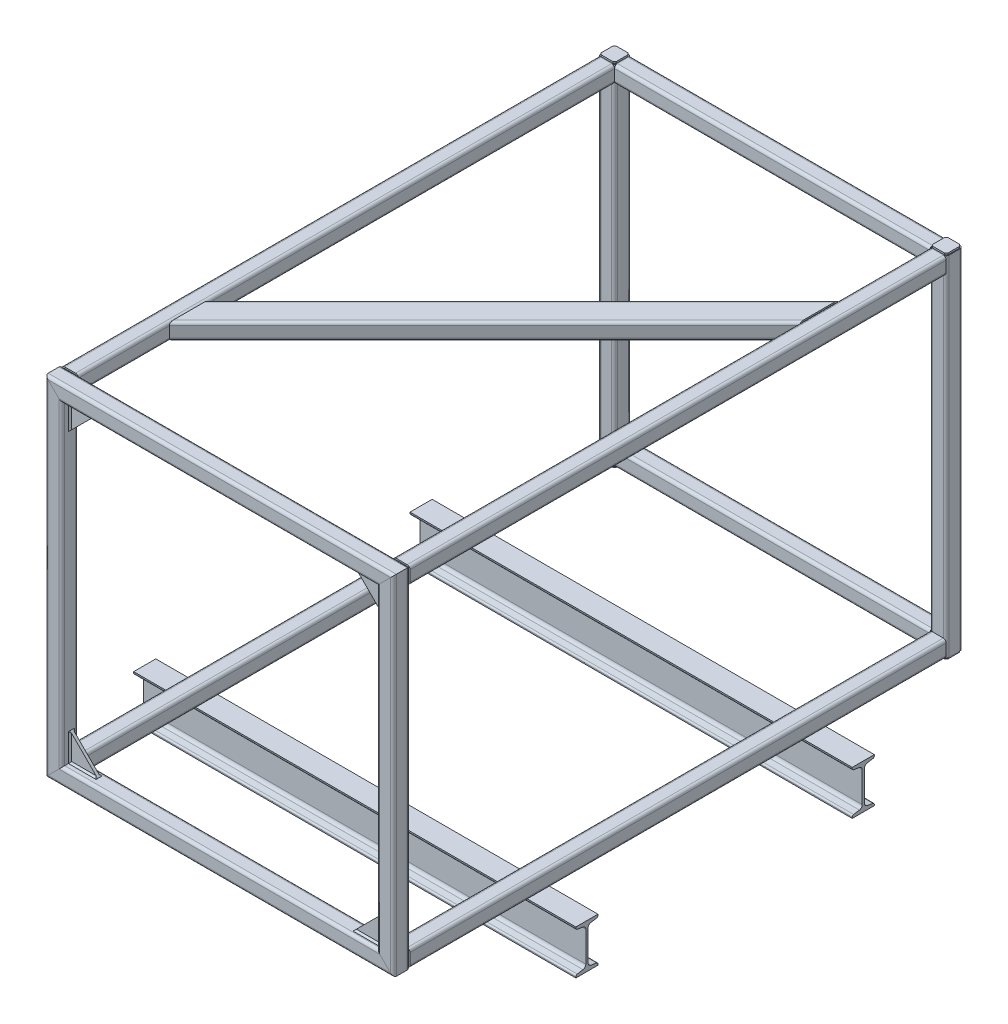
SolidWorks part; units mm, degrees
other "DetailItem1"
other "DetailItem2"
other "DetailItem4"
other "DetailItem5"
ref_plane "Front Plane" through (0, 0, 0) normal (0, 0, 1) x (1, 0, 0)
ref_plane "Top Plane" through (0, 0, 0) normal (0, 1, 0) x (1, 0, 0)
ref_plane "Right Plane" through (0, 0, 0) normal (1, 0, 0) x (0, 0, -1)
sketch "Sketch1" plane through (0, 0, 0) normal (0, 0, 1) x (1, 0, 0)
  line L1 (0, 0) -> (600, 0)
  line L2 (0, 0) -> (0, 600)
  line L3 (0, 600) -> (600, 600)
  line L4 (600, 0) -> (600, 600)
  dimension "D1" = 600
  dimension "D2" = 600
sketch3d "3DSketch1"
  line L0 (0, 0, 0) -> (0, 0, -1000)
  line L1 (600, 0, 0) -> (600, 0, -1000)
  line L2 (600, 600, 0) -> (600, 600, -1000)
  line L3 (0, 600, 0) -> (0, 600, -1000)
  line L4 (0, 0, -1000) -> (0, 600, -1000)
  line L5 (0, 600, -1000) -> (600, 600, -1000)
  line L6 (600, 600, -1000) -> (600, 0, -1000)
  line L7 (600, 0, -1000) -> (0, 0, -1000)
  dimension "D1" = 1000
  dimension "D2" = 1000
  dimension "D3" = 1000
  dimension "D4" = 1000
ref_plane "Plane1" through (0, 600, 0) normal (0, 1, 0) x (-1, 0, 0)
sketch "Sketch2" plane through (0, 600, 0) normal (0, 1, 0) x (-1, 0, 0)
  line L0 (-600, -800) -> (0, -200)
  line L1 (-600, 0) -> (-600, -1000) construction
  line L2 (0, 0) -> (0, -1000) construction
  dimension "D1" = 200
  dimension "D2" = 200
other "Structural Member1"
ref_plane "Plane3" through (0, 0, 0) normal (0, 1, 0) x (-1, 0, 0)
sketch "Sketch12" plane through (0, 0, 0) normal (0, 1, 0) x (-1, 0, 0)
  line L0 (-9.8, -12.4) -> (9.8, -12.4)
  line L1 (-12.4, -9.8) -> (-12.4, 9.8)
  line L2 (9.8, 12.4) -> (-9.8, 12.4)
  line L3 (12.4, 9.8) -> (12.4, -9.8)
  line L4 (-9.8, -15) -> (9.8, -15)
  line L5 (-15, -9.8) -> (-15, 9.8)
  line L6 (9.8, 15) -> (-9.8, 15)
  line L7 (15, 9.8) -> (15, -9.8)
  arc A0 (15, 9.8) -> (9.8, 15) centre (9.8, 9.8) ccw
  arc A1 (9.8, -15) -> (15, -9.8) centre (9.8, -9.8) ccw
  arc A2 (-15, -9.8) -> (-9.8, -15) centre (-9.8, -9.8) ccw
  arc A3 (-9.8, 15) -> (-15, 9.8) centre (-9.8, 9.8) ccw
  arc A4 (-9.8, 12.4) -> (-12.4, 9.8) centre (-9.8, 9.8) ccw
  arc A5 (12.4, 9.8) -> (9.8, 12.4) centre (9.8, 9.8) ccw
  arc A6 (9.8, -12.4) -> (12.4, -9.8) centre (9.8, -9.8) ccw
  arc A7 (-12.4, -9.8) -> (-9.8, -12.4) centre (-9.8, -9.8) ccw
  point P0 (-15, 0)
  point P1 (15, 0)
  point P2 (0, 15)
  point P3 (0, -15)
  point P4 (0, 0)
  point P5 (-15, -15)
  point P6 (15, -15)
  point P7 (15, 15)
  point P8 (-15, 15)
  point P33 (0, 0)
  dimension "D1" = 5.2
  dimension "Thickness" = 2.6
  dimension "V_leg" = 30
other "Structural Member2"
ref_plane "Plane4" through (0, 600, 0) normal (0, 0, -1) x (-1, 0, 0)
sketch "Sketch13" plane through (0, 600, 0) normal (0, 0, -1) x (-1, 0, 0)
  line L0 (-9.8, -12.4) -> (9.8, -12.4)
  line L1 (-12.4, -9.8) -> (-12.4, 9.8)
  line L2 (9.8, 12.4) -> (-9.8, 12.4)
  line L3 (12.4, 9.8) -> (12.4, -9.8)
  line L4 (-9.8, -15) -> (9.8, -15)
  line L5 (-15, -9.8) -> (-15, 9.8)
  line L6 (9.8, 15) -> (-9.8, 15)
  line L7 (15, 9.8) -> (15, -9.8)
  arc A0 (15, 9.8) -> (9.8, 15) centre (9.8, 9.8) ccw
  arc A1 (9.8, -15) -> (15, -9.8) centre (9.8, -9.8) ccw
  arc A2 (-15, -9.8) -> (-9.8, -15) centre (-9.8, -9.8) ccw
  arc A3 (-9.8, 15) -> (-15, 9.8) centre (-9.8, 9.8) ccw
  arc A4 (-9.8, 12.4) -> (-12.4, 9.8) centre (-9.8, 9.8) ccw
  arc A5 (12.4, 9.8) -> (9.8, 12.4) centre (9.8, 9.8) ccw
  arc A6 (9.8, -12.4) -> (12.4, -9.8) centre (9.8, -9.8) ccw
  arc A7 (-12.4, -9.8) -> (-9.8, -12.4) centre (-9.8, -9.8) ccw
  point P0 (-15, 0)
  point P1 (15, 0)
  point P2 (0, 15)
  point P3 (0, -15)
  point P4 (0, 0)
  point P5 (-15, -15)
  point P6 (15, -15)
  point P7 (15, 15)
  point P8 (-15, 15)
  point P33 (0, 0)
  dimension "D1" = 5.2
  dimension "Thickness" = 2.6
  dimension "V_leg" = 30
other "Structural Member3"
ref_plane "Plane5" through (0, 0, -1000) normal (0, 1, 0) x (-1, 0, 0)
sketch "Sketch14" plane through (0, 0, -1000) normal (0, 1, 0) x (-1, 0, 0)
  line L0 (-9.8, -12.4) -> (9.8, -12.4)
  line L1 (-12.4, -9.8) -> (-12.4, 9.8)
  line L2 (9.8, 12.4) -> (-9.8, 12.4)
  line L3 (12.4, 9.8) -> (12.4, -9.8)
  line L4 (-9.8, -15) -> (9.8, -15)
  line L5 (-15, -9.8) -> (-15, 9.8)
  line L6 (9.8, 15) -> (-9.8, 15)
  line L7 (15, 9.8) -> (15, -9.8)
  arc A0 (15, 9.8) -> (9.8, 15) centre (9.8, 9.8) ccw
  arc A1 (9.8, -15) -> (15, -9.8) centre (9.8, -9.8) ccw
  arc A2 (-15, -9.8) -> (-9.8, -15) centre (-9.8, -9.8) ccw
  arc A3 (-9.8, 15) -> (-15, 9.8) centre (-9.8, 9.8) ccw
  arc A4 (-9.8, 12.4) -> (-12.4, 9.8) centre (-9.8, 9.8) ccw
  arc A5 (12.4, 9.8) -> (9.8, 12.4) centre (9.8, 9.8) ccw
  arc A6 (9.8, -12.4) -> (12.4, -9.8) centre (9.8, -9.8) ccw
  arc A7 (-12.4, -9.8) -> (-9.8, -12.4) centre (-9.8, -9.8) ccw
  point P0 (-15, 0)
  point P1 (15, 0)
  point P2 (0, 15)
  point P3 (0, -15)
  point P4 (0, 0)
  point P5 (-15, -15)
  point P6 (15, -15)
  point P7 (15, 15)
  point P8 (-15, 15)
  point P33 (0, 0)
  dimension "D1" = 5.2
  dimension "Thickness" = 2.6
  dimension "V_leg" = 30
other "Structural Member4"
ref_plane "Plane6" through (600, 600, -800) normal (-0.7071, 0, 0.7071) x (0.7071, 0, 0.7071)
sketch "Sketch15" plane through (600, 600, -800) normal (-0.7071, 0, 0.7071) x (0, -1, 0)
  line L0 (-9.8, -22.4) -> (9.8, -22.4)
  line L1 (-12.4, -19.8) -> (-12.4, 19.8)
  line L2 (9.8, 22.4) -> (-9.8, 22.4)
  line L3 (12.4, 19.8) -> (12.4, -19.8)
  line L4 (-9.8, -25) -> (9.8, -25)
  line L5 (-15, -19.8) -> (-15, 19.8)
  line L6 (9.8, 25) -> (-9.8, 25)
  line L7 (15, 19.8) -> (15, -19.8)
  arc A0 (15, 19.8) -> (9.8, 25) centre (9.8, 19.8) ccw
  arc A1 (9.8, -25) -> (15, -19.8) centre (9.8, -19.8) ccw
  arc A2 (-15, -19.8) -> (-9.8, -25) centre (-9.8, -19.8) ccw
  arc A3 (-9.8, 25) -> (-15, 19.8) centre (-9.8, 19.8) ccw
  arc A4 (-9.8, 22.4) -> (-12.4, 19.8) centre (-9.8, 19.8) ccw
  arc A5 (12.4, 19.8) -> (9.8, 22.4) centre (9.8, 19.8) ccw
  arc A6 (9.8, -22.4) -> (12.4, -19.8) centre (9.8, -19.8) ccw
  arc A7 (-12.4, -19.8) -> (-9.8, -22.4) centre (-9.8, -19.8) ccw
  point P0 (0, 25)
  point P1 (15, 0)
  point P2 (0, -25)
  point P3 (-15, 0)
  point P4 (-15, 25)
  point P5 (15, 25)
  point P6 (15, -25)
  point P7 (-15, -25)
  point P8 (0, 0)
  point P33 (0, 0)
  dimension "D1" = 5.2
  dimension "Thickness" = 2.6
  dimension "V_leg" = 50
  dimension "H_leg" = 30
other "Trim/Extend1"
other "Trim/Extend2"
other "Trim/Extend3"
other "Trim/Extend4"
other "Trim/Extend5"
other "Trim/Extend6"
other "Trim/Extend7"
other "End cap1" parameters "D1"=3, "D2"=3, "D3"=3
other "End cap2" parameters "D1"=3, "D2"=3, "D3"=3
other "End cap3" parameters "D1"=3, "D2"=3, "D3"=3
other "End cap4" parameters "D1"=3, "D2"=3, "D3"=3
other "Gusset1" parameters "D1"=5, "D2"=5, "D3"=0, "D4"=0, "D10"=5, "D11"=50, "D12"=50, "D13"=15, "D14"=45, "D15"=15
sketch "Sketch16" plane through (15, 15, 0) normal (0, 0, -1) x (-1, 0, 0)
  line L0 (0, 0) -> (0, 50)
  line L1 (0, 0) -> (-50, 0)
  line L2 (0, 50) -> (-50, 0)
other "Gusset2" parameters "D1"=5, "D2"=5, "D3"=0, "D4"=0, "D10"=5, "D11"=50, "D12"=50, "D13"=15, "D14"=45, "D15"=15
sketch "Sketch17" plane through (15, 585, 0) normal (0, 0, -1) x (-1, 0, 0)
  line L0 (0, 0) -> (-50, 0)
  line L1 (0, 0) -> (0, -50)
  line L2 (-50, 0) -> (0, -50)
other "Gusset3" parameters "D1"=5, "D2"=5, "D3"=0, "D4"=0, "D10"=5, "D11"=50, "D12"=50, "D13"=15, "D14"=45, "D15"=15
sketch "Sketch18" plane through (585, 585, 0) normal (0, 0, 1) x (1, 0, 0)
  line L0 (0, 0) -> (-50, 0)
  line L1 (0, 0) -> (0, -50)
  line L2 (-50, 0) -> (0, -50)
other "Gusset4" parameters "D1"=5, "D2"=5, "D3"=0, "D4"=0, "D10"=5, "D11"=50, "D12"=50, "D13"=15, "D14"=45, "D15"=15
sketch "Sketch19" plane through (585, 15, 0) normal (0, 0, 1) x (1, 0, 0)
  line L0 (0, 0) -> (0, 50)
  line L1 (0, 0) -> (-50, 0)
  line L2 (0, 50) -> (-50, 0)
other "Fillet Bead1" parameters "D10"=6, "D11"=3, "D12"=3, "D13"=3, "D14"=3
other "Fillet Bead2" parameters "D10"=6, "D11"=3, "D12"=3, "D13"=3, "D14"=3
other "Fillet Bead3" parameters "D10"=6, "D11"=3, "D12"=3, "D13"=3, "D14"=3
other "Fillet Bead4" parameters "D10"=6, "D11"=3, "D12"=3, "D13"=3, "D14"=3
sketch "Sketch20" plane through (0, -15, 0) normal (0, -1, 0) x (1, 0, 0)
  line L0 (-100, -250) -> (700, -250)
  line L1 (0, -500) -> (600, -500) construction
  line L2 (0, 0) -> (0, -1000) construction
  line L3 (600, 0) -> (600, -1000) construction
  line L4 (-100, -750) -> (700, -750)
  dimension "D1" = 800
  dimension "D2" = 100
  dimension "D3" = 250
other "Structural Member5"
ref_plane "Plane7" through (-100, -15, -250) normal (1, 0, 0) x (0, 0, -1)
sketch "Sketch161" plane through (-100, -55, -250) normal (1, 0, 0) x (0, 0, -1)
  line L0 (-20, -40) -> (-20, -38.0415)
  line L1 (-17.4932, -35.0823) -> (-7.0135, -33.3355)
  line L2 (-2, -27.4172) -> (-2, 27.4172)
  line L3 (-7.0135, 33.3355) -> (-17.4932, 35.0823)
  line L4 (-20, 38.0415) -> (-20, 40)
  line L5 (-20, 40) -> (20, 40)
  line L6 (20, 40) -> (20, 38.0415)
  line L7 (17.4932, 35.0823) -> (7.0135, 33.3355)
  line L8 (2, 27.4172) -> (2, -27.4172)
  line L9 (7.0135, -33.3355) -> (17.4932, -35.0823)
  line L10 (20, -38.0415) -> (20, -40)
  line L11 (20, -40) -> (-20, -40)
  line L15 (-2, 0) -> (2, 0) construction
  arc A0 (-7.0135, -33.3355) -> (-2, -27.4172) centre (-8, -27.4172) ccw
  arc A1 (-2, 27.4172) -> (-7.0135, 33.3355) centre (-8, 27.4172) ccw
  arc A2 (7.0135, 33.3355) -> (2, 27.4172) centre (8, 27.4172) ccw
  arc A3 (2, -27.4172) -> (7.0135, -33.3355) centre (8, -27.4172) ccw
  arc A4 (-17.4932, 35.0823) -> (-20, 38.0415) centre (-17, 38.0415) cw
  arc A5 (17.4932, 35.0823) -> (20, 38.0415) centre (17, 38.0415) ccw
  arc A6 (-20, -38.0415) -> (-17.4932, -35.0823) centre (-17, -38.0415) cw
  arc A7 (20, -38.0415) -> (17.4932, -35.0823) centre (17, -38.0415) ccw
  point P1 (0, 40)
  point P8 (0, -40)
  point P21 (0, 0)
  point P34 (0, 0)
  dimension "RI" = 6
  dimension "D3" = 3
  dimension "BF" = 40
  dimension "D2" = 9.463
  dimension "DEPTH" = 80
  dimension "TW" = 4
  dimension "D1" = 54.8344
